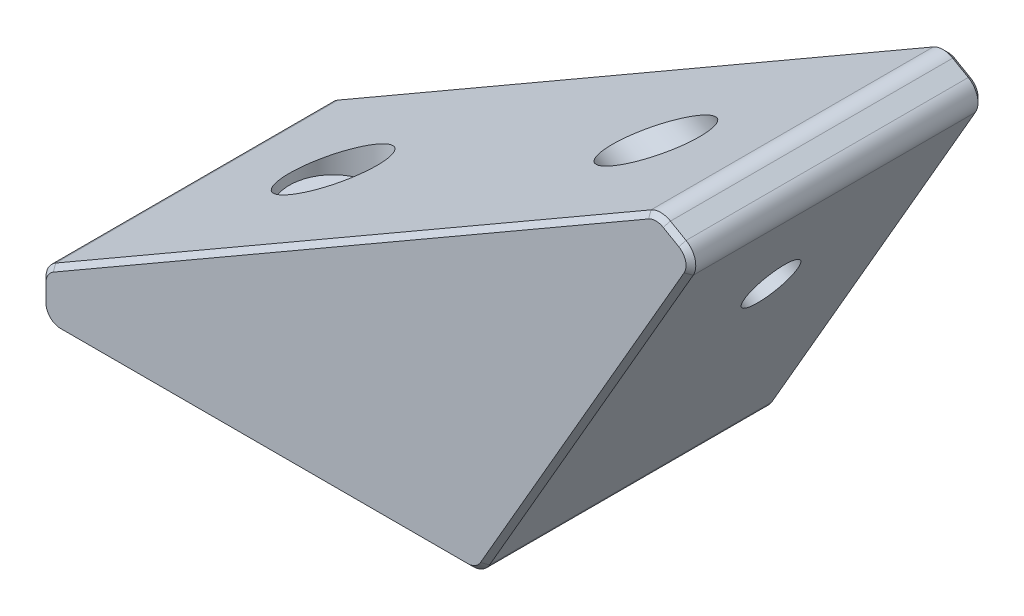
SolidWorks part; units mm, degrees
ref_plane "Płaszczyzna przednia" through (0, 0, 0) normal (0, 0, 1) x (1, 0, 0)
ref_plane "Płaszczyzna górna" through (0, 0, 0) normal (0, 1, 0) x (1, 0, 0)
ref_plane "Płaszczyzna prawa" through (0, 0, 0) normal (1, 0, 0) x (0, 0, -1)
sketch "Szkic1" plane through (0, 0, 0) normal (0, 0, 1) x (1, 0, 0)
  line L0 (0, 0) -> (0, 5)
  line L1 (0, 5) -> (42.1132, 5) construction
  line L2 (42.1132, 5) -> (63.1699, 41.4711) construction
  line L3 (63.1699, 41.4711) -> (67.5, 38.9711)
  line L4 (67.5, 38.9711) -> (45, 0)
  line L5 (45, 0) -> (0, 0)
  line L6 (0, 5) -> (63.1699, 41.4711)
  dimension "D1" = 120
  dimension "D2" = 45
  dimension "D3" = 5
extrude "Dodanie-wyciągnięcie1" add sketch "Szkic1" along normal blind 30
sketch "Szkic3" plane through (0, 0, 0) normal (0, -1, 0) x (1, 0, 0)
  line L0 (0, 15) -> (45, 15)
  line L1 (0, 30) -> (0, 0) construction
  line L2 (45, 30) -> (45, 0) construction
  point P6 (15, 15)
  dimension "D1" = 15
sketch "Szkic4" plane through (33.75, -19.4856, 0) normal (0.866, -0.5, 0) x (0, 0, -1)
  line L0 (-15, 22.5) -> (-15, 67.5)
  line L1 (-30, 67.5) -> (0, 67.5) construction
  point P5 (-15, 52.5)
  dimension "D1" = 15
hole_wizard "Otwór pod śrubę M51" positions "Szkic5" profile "Szkic6" hole size "M5" standard "DIN"
sketch "Szkic5" plane through (33.75, -19.4856, 0) normal (0.866, -0.5, 0) x (0, 0, -1)
  point P0 (-15, 52.5)
sketch "Szkic6" plane through (60, 25.9808, 15) normal (0, 0, 1) x (0.5, 0.866, 0)
  line L0 (0, 0) -> (0, 59.7067)
  line L1 (0, 59.7067) -> (2.75, 59.7067)
  line L2 (2.75, 59.7067) -> (2.75, 0)
  line L5 (2.75, 0) -> (0, 0)
  line L11 (0, -6.35) -> (0, 107.95) construction
  dimension "Średnica otworu na wylot" = 5.5
  dimension "Głębokość otworu na wylot" = 59.7067
hole_wizard "Otwór pod śrubę M52" positions "Szkic7" profile "Szkic8" hole size "M5" standard "DIN"
sketch "Szkic7" plane through (0, 0, 0) normal (0, -1, 0) x (-1, 0, 0)
  point P0 (-15, -15)
sketch "Szkic8" plane through (15, 0, 15) normal (1, 0, 0) x (0, 0, -1)
  line L0 (0, 0) -> (0, 41.4711)
  line L1 (0, 41.4711) -> (2.75, 41.4711)
  line L2 (2.75, 41.4711) -> (2.75, 0)
  line L5 (2.75, 0) -> (0, 0)
  line L11 (0, -6.35) -> (0, 107.95) construction
  dimension "Średnica otworu na wylot" = 5.5
  dimension "Głębokość otworu na wylot" = 41.4711
sketch "Szkic9" plane through (33.75, -19.4856, 0) normal (0.866, -0.5, 0) x (0, 0, -1)
  circle A0 centre (-15, 52.5) radius 4.5
  dimension "D1" = 9
extrude "Wytnij-wyciągnięcie1" cut sketch "Szkic9" against normal blind 30 from offset 10
sketch "Szkic10" plane through (0, 0, 0) normal (0, -1, 0) x (1, 0, 0)
  circle A0 centre (15, 15) radius 4.5
  dimension "D1" = 9
extrude "Wytnij-wyciągnięcie2" cut sketch "Szkic10" against normal blind 30 from offset 10
fillet "Zaokrąglenie1" radius 2 5 edges at (45, 0, 15) (0, 0, 15) (0, 5, 15) (63.1699, 41.4711, 15) (67.5, 38.9711, 15)
chamfer "Sfazowanie1" distance 0.5 angle 45 20 edges at (66.6998, 38.7567, 0) (64.9689, 40.4325, 0) (63.1699, 41.1617, 0) (31.5849, 23.2356, 0) (0.2679, 4.8453, 0) (0, 2.9226, 0) (0.5858, 0.5858, 0) (22.9226, 0, 0) (44.8453, 0.2679, 0) (56.0387, 19.1195, 0) (0.5858, 0.5858, 30) (0, 2.9226, 30) (0.2679, 4.8453, 30) (31.5849, 23.2356, 30) (63.1699, 41.1617, 30) (64.9689, 40.4325, 30) (66.6998, 38.7567, 30) (56.0387, 19.1195, 30) (44.8453, 0.2679, 30) (22.9226, 0, 30)
